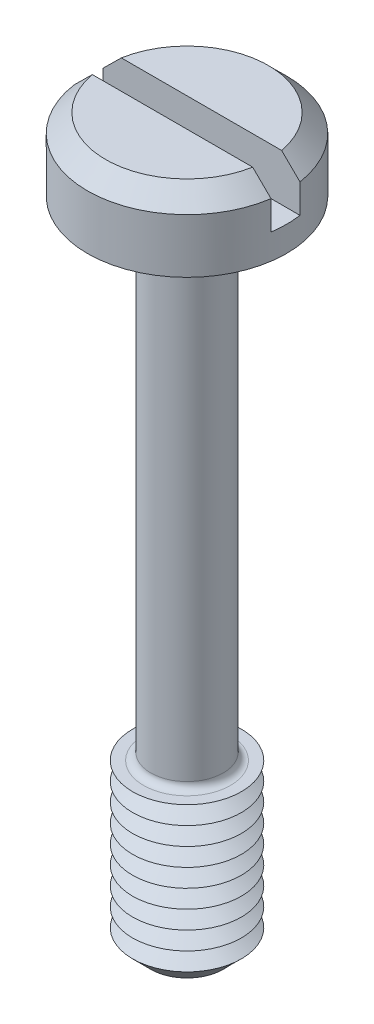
SolidWorks part; units mm, degrees
ref_plane "Front Plane" through (0, 0, 0) normal (0, 0, 1) x (1, 0, 0)
ref_plane "Top Plane" through (0, 0, 0) normal (0, 1, 0) x (1, 0, 0)
ref_plane "Right Plane" through (0, 0, 0) normal (1, 0, 0) x (0, 0, -1)
sketch "Sketch1" plane through (0, 0, 0) normal (0, 1, 0) x (1, 0, 0)
  circle A0 centre (0, 0) radius 2.75
  dimension "D1" = 5.5
extrude "Boss-Extrude1" add sketch "Sketch1" along normal blind 2
sketch "Sketch2" plane through (0, 0, 0) normal (0, -1, 0) x (1, 0, 0)
  circle A0 centre (0, 0) radius 1
  dimension "D1" = 2
extrude "Boss-Extrude2" add sketch "Sketch2" along normal blind 18
sketch "Sketch3" plane through (0, -18, 0) normal (0, -1, 0) x (1, 0, 0)
  circle A0 centre (0, 0) radius 1.5
  dimension "D1" = 3
extrude "Boss-Extrude3" add sketch "Sketch3" against normal blind 4.5
chamfer "Chamfer1" distance 0.5 angle 45 1 edges at (0, -18, -1.5)
sketch "Sketch4" plane through (0, 0, 0) normal (1, 0, 0) x (0, 0, -1)
  line L0 (0, -6.5871) -> (0, -12.0372) construction
sketch "Sketch5" plane through (0, 0, 0) normal (1, 0, 0) x (0, 0, -1)
  line L0 (-1.5, -13.5) -> (-1.067, -13.75)
  line L1 (-1.067, -13.75) -> (-1.5, -14)
  line L2 (-1.5, -13.5) -> (-1.5, -17.5) construction
  line L3 (-1.5, -14) -> (-1.5, -13.5)
  dimension "D1" = 0.5
revolve "Cut-Revolve1" cut sketch "Sketch5" angle 360 about L0
pattern_linear "LPattern1" count 8 spacing 0.5 along (0, -1, 0) of "Cut-Revolve1"
fillet "Fillet1" radius 0.2 2 edges at (0, -13.5, -1) (0, 0, -1)
chamfer "Chamfer2" distance 0.5 angle 45 1 edges at (0, 2, 2.75)
sketch "Sketch6" plane through (0, 2, 0) normal (0, 1, 0) x (1, 0, 0)
  line L1 (2.75, -0.4) -> (-2.75, -0.4)
  line L2 (2.75, -0.4) -> (2.75, 0.4)
  line L3 (2.75, 0.4) -> (-2.75, 0.4)
  line L4 (-2.75, -0.4) -> (-2.75, 0.4)
  line L5 (2.75, -0.4) -> (-2.75, 0.4) construction
  line L6 (2.75, 0.4) -> (-2.75, -0.4) construction
  circle A0 centre (0, 0) radius 2.75 construction
  point P0 (0, 0)
  dimension "D1" = 0.8
extrude "Cut-Extrude1" cut sketch "Sketch6" against normal blind 1.3
